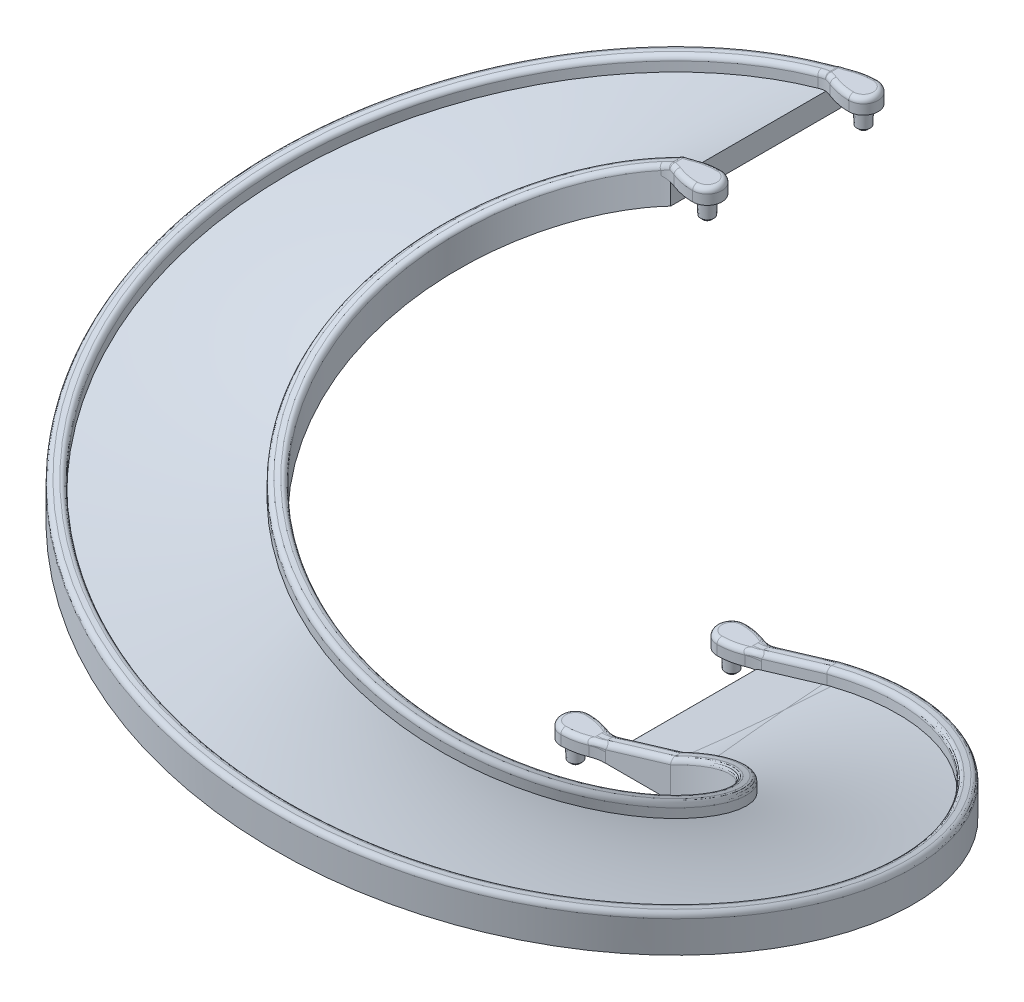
SolidWorks part; units mm, degrees
ref_plane "Front Plane" through (0, 0, 0) normal (0, 0, 1) x (1, 0, 0)
ref_plane "Top Plane" through (0, 0, 0) normal (0, 1, 0) x (1, 0, 0)
ref_plane "Right Plane" through (0, 0, 0) normal (1, 0, 0) x (0, 0, -1)
body saved out of another part "Stock-V1-1"
move or copy body "Body-Move/Copy1" bodies to move or copy 101 copy no rotation origin (175.0386, 0, 0.4281) rotation axis (0, 1, 0) rotation angle 180
